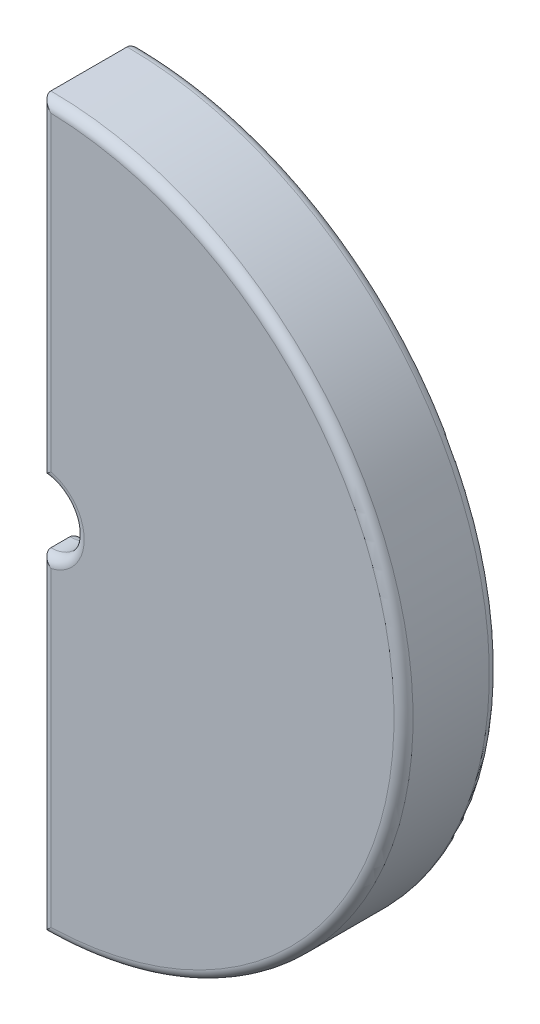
SolidWorks part; units mm, degrees
ref_plane "Спереди" through (0, 0, 0) normal (0, 0, 1) x (1, 0, 0)
ref_plane "Сверху" through (0, 0, 0) normal (0, 1, 0) x (1, 0, 0)
ref_plane "Справа" through (0, 0, 0) normal (1, 0, 0) x (0, 0, -1)
sketch "Эскиз1" plane through (0, 0, 0) normal (0, 0, 1) x (1, 0, 0)
  line L0 (0, 1.75) -> (0, 19)
  line L1 (0, -1.75) -> (0, -19)
  arc A0 (0, -19) -> (0, 19) centre (0, 0) ccw
  arc A1 (0, -1.75) -> (0, 1.75) centre (0, 0) ccw
  dimension "D1" = 38
  dimension "D2" = 3.5
extrude "Бобышка-Вытянуть1" add sketch "Эскиз1" along normal mid plane 5
sketch "Эскиз2" plane through (0, 0, -2.5) normal (0, 0, -1) x (-1, 0, 0)
  circle A0 centre (0, 0) radius 4.5
  dimension "D1" = 9
extrude "Вырез-Вытянуть1" cut sketch "Эскиз2" against normal blind 3
fillet "Скругление1" radius 0.5 14 edges at (0, 4.5, -1) (0, -4.5, -1) (0, 10.375, 2.5) (19, 0, 2.5) (0, -10.375, 2.5) (1.75, 0, 2.5) (4.5, 0, 0.5) (0, 3.125, 0.5) (1.75, 0, 0.5) (0, -3.125, 0.5) (19, 0, -2.5) (0, 11.75, -2.5) (4.5, 0, -2.5) (0, -11.75, -2.5)
